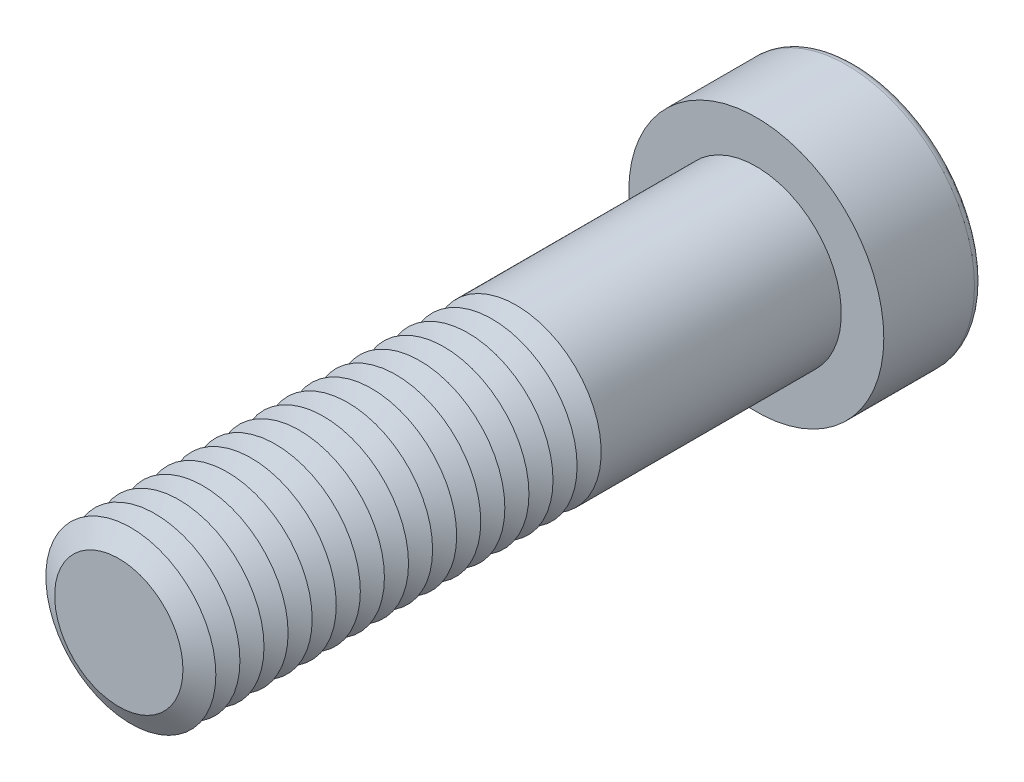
SolidWorks part; units mm, degrees
ref_plane "Front Plane" through (0, 0, 0) normal (0, 0, 1) x (1, 0, 0)
ref_plane "Top Plane" through (0, 0, 0) normal (0, 1, 0) x (1, 0, 0)
ref_plane "Right Plane" through (0, 0, 0) normal (1, 0, 0) x (0, 0, -1)
sketch "Sketch1" plane through (0, 0, 0) normal (0, 0, 1) x (1, 0, 0)
  circle A0 centre (0, 0) radius 6
  dimension "D1" = 12
extrude "Boss-Extrude1" add sketch "Sketch1" along normal blind 45
sketch "Sketch2" plane through (0, 0, 0) normal (0, 0, -1) x (-1, 0, 0)
  circle A0 centre (0, 0) radius 9
  dimension "D1" = 18
extrude "Boss-Extrude2" add sketch "Sketch2" along normal blind 7
sketch "Sketch3" plane through (0, 0, -7) normal (0, 0, -1) x (-1, 0, 0)
  line L1 (-2.3094, 4) -> (-4.6188, 0)
  line L2 (-4.6188, 0) -> (-2.3094, -4)
  line L3 (-2.3094, -4) -> (2.3094, -4)
  line L4 (2.3094, -4) -> (4.6188, 0)
  line L5 (4.6188, 0) -> (2.3094, 4)
  line L6 (2.3094, 4) -> (-2.3094, 4)
  circle A0 centre (0, 0) radius 4 construction
  dimension "D1" = 8
extrude "Cut-Extrude1" cut sketch "Sketch3" against normal blind 6
fillet "Fillet1" radius 0.6 1 edges at (-9, 0, -7)
sketch "Sketch4" plane through (0, 0, -1) normal (0, 0, -1) x (-1, 0, 0)
  line L0 (2.3094, -4) -> (4.6188, 0) construction
  circle A0 centre (0, 0) radius 4
extrude "Cut-Extrude2" cut sketch "Sketch4" against normal through all draft 60
sketch "Sketch5" plane through (0, 0, -7) normal (0, 0, -1) x (-1, 0, 0)
  circle A0 centre (0, 0) radius 4.6188
extrude "Cut-Extrude3" cut sketch "Sketch5" against normal through all draft 75
sketch "Sketch7" plane through (0, 0, 0) normal (1, 0, 0) x (0, 0, -1)
  line L25 (-45, 4.5278) -> (-44.15, 6)
  line L26 (-45, 6) -> (-45, -6) construction
  line L27 (-44.15, 6) -> (-45.85, 6)
  line L28 (-45.85, 6) -> (-45, 4.5278)
  line L29 (0, 6) -> (-45, 6) construction
  dimension "D1" = 1.7
revolve "Cut-Revolve1" cut sketch "Sketch7" angle 360 about axis through (0, 0, 45) along (0, 0, -1)
pattern_linear "LPattern1" count 17 spacing 1.7 along (0, 0, -1) of "Cut-Revolve1"
